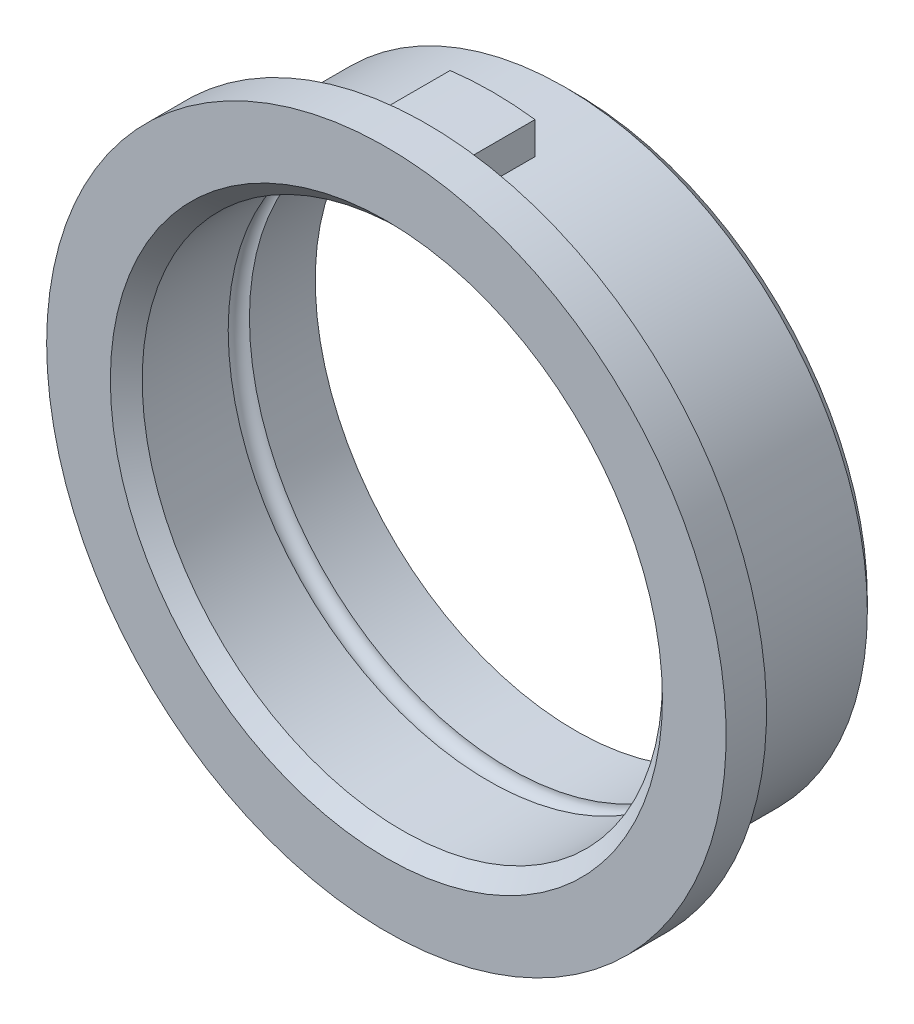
SolidWorks part; units mm, degrees
ref_plane "Plan1" through (0, 0, 0) normal (0, 0, 1) x (1, 0, 0)
ref_plane "Plan2" through (0, 0, 0) normal (0, 1, 0) x (1, 0, 0)
ref_plane "Plan3" through (0, 0, 0) normal (1, 0, 0) x (0, 0, -1)
sketch "Esquisse1" plane through (0, 0, 0) normal (0, 0, 1) x (1, 0, 0)
  circle A1 centre (0, -31.75) radius 12.25
  circle A3 centre (0, -31.75) radius 14.25
  dimension "D1" = 28.5
  dimension "D2" = 2
extrude "Base-Extrusion" add sketch "Esquisse1" against normal blind 7
sketch "Esquisse2" plane through (0, 0, 0) normal (0, 0, 1) x (1, 0, 0)
  circle A0 centre (0, -31.75) radius 12.25 construction
  circle A1 centre (0, -31.75) radius 12.25
  circle A2 centre (0, -31.75) radius 16
  dimension "D1" = 3.75
extrude "Boss.-Extru.1" add sketch "Esquisse2" along normal blind 1.9
chamfer "Chanfrein1" distance 0.5 angle 45
chamfer "Chanfrein2" distance 0.75 angle 45
sketch "Esquisse3" plane through (0, 0, 0) normal (1, 0, 0) x (0, 0, -1)
  line L0 (7, -19.5) -> (-1.15, -19.5) construction
  line L1 (3.4, -19.5) -> (3.9, -19.5)
  line L3 (3.4, -19.5) -> (2.9, -19.5)
  line L4 (7, -45.5) -> (7, -18) construction
  line L5 (8.3434, -31.75) -> (-4.3542, -31.75) construction
  line L6 (48.4501, -31.75) -> (7.3, -31.75) construction
  arc A0 (3.9, -19.5) -> (2.9, -19.5) centre (3.4, -19.5) ccw
  dimension "D1" = 0.5
  dimension "D2" = 3.6
revolve "Enlèvement de matière-Révolution1" cut sketch "Esquisse3" angle 360 about L5
sketch "Esquisse4" plane through (0, 0, 0) normal (0, 0, -1) x (-1, 0, 0)
  line L0 (0, -31.75) -> (0, -10.6938) construction
  line L1 (2, -16.1275) -> (2, -17.641)
  line L2 (-2, -16.1275) -> (-2, -17.641)
  arc A0 (2, -16.1275) -> (-2, -16.1275) centre (0, -31.75) ccw
  circle A1 centre (0, -31.75) radius 14.25 construction
  arc A2 (2, -17.641) -> (-2, -17.641) centre (0, -31.75) ccw
  dimension "D1" = 31.5
  dimension "D2" = 2
extrude "Boss.-Extru.2" add sketch "Esquisse4" along normal blind 3.1
